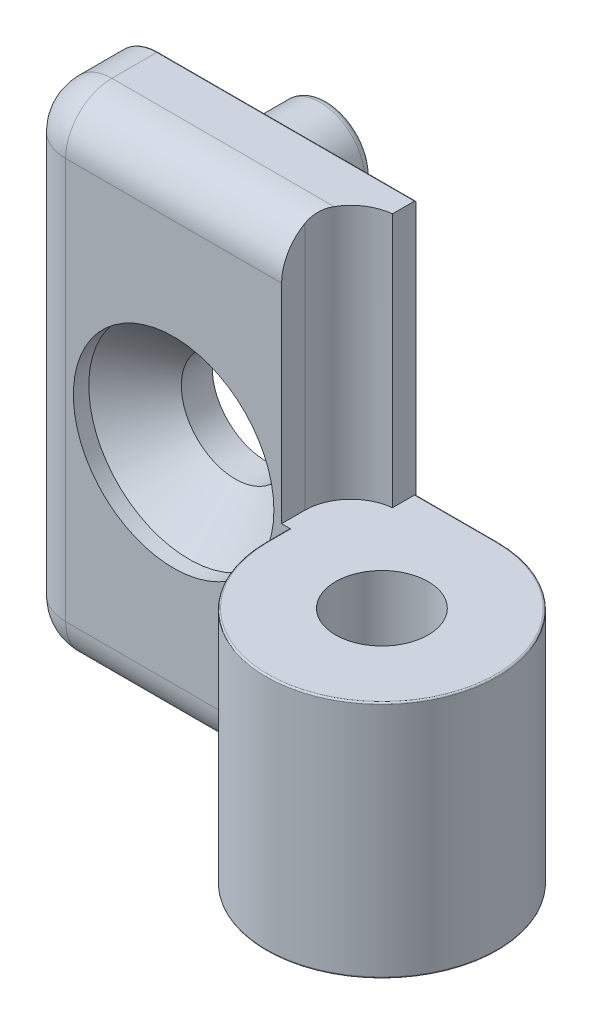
SolidWorks part; units mm, degrees
ref_plane "正面" through (0, 0, 0) normal (0, 0, 1) x (1, 0, 0)
ref_plane "平面" through (0, 0, 0) normal (0, 1, 0) x (1, 0, 0)
ref_plane "右側面" through (0, 0, 0) normal (1, 0, 0) x (0, 0, -1)
sketch "ｽｹｯﾁ1" plane through (0, 0, 0) normal (0, 1, 0) x (1, 0, 0)
  line L1 (-7.6, 1.5) -> (-7.5, 1.5)
  line L2 (-7.6, 7.5) -> (-7.6, 1.5)
  line L3 (-7.5, 0) -> (-7.5, 1.5)
  line L4 (-7.6, 7.5) -> (0, 7.5)
  arc A0 (0, 7.5) -> (-7.5, 0) centre (0, 0) cw
extrude "押し出し1" add sketch "ｽｹｯﾁ1" along normal blind 15.5
sketch "ｽｹｯﾁ2" plane through (0, 0, 0) normal (0, -1, 0) x (1, 0, 0)
  line L2 (-25, -4.5) -> (-25, -7.5)
  line L3 (-22, -1.5) -> (-5.3, -1.5)
  line L4 (-25, -7.5) -> (-5.3, -7.5)
  line L5 (-5.3, -1.5) -> (-5.3, -7.5)
  arc A0 (-25, -4.5) -> (-22, -1.5) centre (-22, -4.5) cw
sketch "ｽｹｯﾁ10" plane through (0, 15.5, 0) normal (0, 1, 0) x (1, 0, 0)
  circle A0 centre (0, 0) radius 3
  dimension "D1" = 6
extrude "ｶｯﾄ - 押し出し2" cut sketch "ｽｹｯﾁ10" against normal blind 13.5
extrude "ﾎﾞｽ - 押し出し2" add sketch "ｽｹｯﾁ2" against normal blind 32
sketch "ｽｹｯﾁ11" plane through (0, 32, 0) normal (0, 1, 0) x (1, 0, 0)
  line L0 (-25, 4.5) -> (-25, 7.5) construction
  line L1 (-25, 7.5) -> (-5.3, 7.5) construction
  line L2 (-8, 3) -> (-8, 0)
  line L3 (-5, 0) -> (-8, 0)
  arc A0 (-5, 0) -> (-8, 3) centre (-5, 3) ccw
  dimension "D1" = 6
  dimension "D2" = 20
  dimension "D3" = 4.5
extrude "ｶｯﾄ - 押し出し3" cut sketch "ｽｹｯﾁ11" against normal blind 16.5
sketch "ｽｹｯﾁ12" plane through (0, 0, -7.5) normal (0, 0, -1) x (-1, 0, 0)
  line L0 (0, 0) -> (25, 0) construction
  line L1 (25, 32) -> (25, 0) construction
  circle A1 centre (15, 28) radius 2.9
  circle A3 centre (15, 4) radius 2.9
  dimension "D2" = 5.8
  dimension "D4" = 5.8
  dimension "D5" = 24
  dimension "D6" = 4
  dimension "D7" = 10
extrude "ﾎﾞｽ - 押し出し3" add sketch "ｽｹｯﾁ12" along normal blind 4
fillet "ﾌｨﾚｯﾄ1" radius 0.5 2 edges at (-17.9, 28, -11.5) (-17.9, 4, -11.5)
hole_wizard "穴1" positions "ｽｹｯﾁ14" profile "ｽｹｯﾁ13" legacy
sketch "ｽｹｯﾁ14" plane through (0, 0, -1.5) normal (0, 0, 1) x (1, 0, 0)
  line L0 (-22, 32) -> (-22, 0) construction
  line L1 (-22, 0) -> (-7.5, 0) construction
  point P0 (-15, 16)
  dimension "D1" = 7
  dimension "D2" = 16
sketch "ｽｹｯﾁ13" plane through (-15, 16, -1.5) normal (1, 0, 0) x (0, -1, 0)
  line L0 (0, 0) -> (0, 10)
  line L1 (0, 10) -> (3.5, 10)
  line L2 (3.5, 10) -> (3.5, 4)
  line L3 (3.5, 4) -> (6.5, 1)
  line L4 (6.5, 1) -> (6.5, 0)
  line L6 (6.5, 0) -> (0, 0)
  line L7 (-3.5, 4) -> (-6.5, 1) construction
  line L11 (0, -6.35) -> (0, 107.95) construction
  dimension "通し穴の直径" = 7
  dimension "通し穴の深さ" = 10
  dimension "皿穴の直径" = 13
  dimension "皿穴の角度" = 90
  dimension "ねじのすきま" = 1
fillet "ﾌｨﾚｯﾄ2" radius 3 6 edges at (-25, 0, -6) (-25, 32, -6) (-24.1213, 0, -2.3787) (-24.1213, 32, -2.3787) (-14.75, 0, -1.5) (-15, 32, -1.5)
sketch "ｽｹｯﾁ15" plane through (0, 0, -11.5) normal (0, 0, -1) x (-1, 0, 0)
  circle A0 centre (15, 28) radius 2
  circle A1 centre (15, 4) radius 2
  dimension "D1" = 4
  dimension "D2" = 4
extrude "ｶｯﾄ - 押し出し4" cut sketch "ｽｹｯﾁ15" against normal blind 7.5
fillet "ﾌｨﾚｯﾄ3" radius 0.1 10 edges at (-7.5, 0, -2.25) (-13.65, 32, -7.5) (-24.1213, 31.1213, -7.5) (-25, 16, -7.5) (-24.1213, 0.8787, -7.5) (-11, 0, -7.5) (-7.5, 15.5, -0.75) (-2.65, 15.5, -7.5) (5.3033, 0, 5.3033) (5.3033, 15.5, 5.3033)
